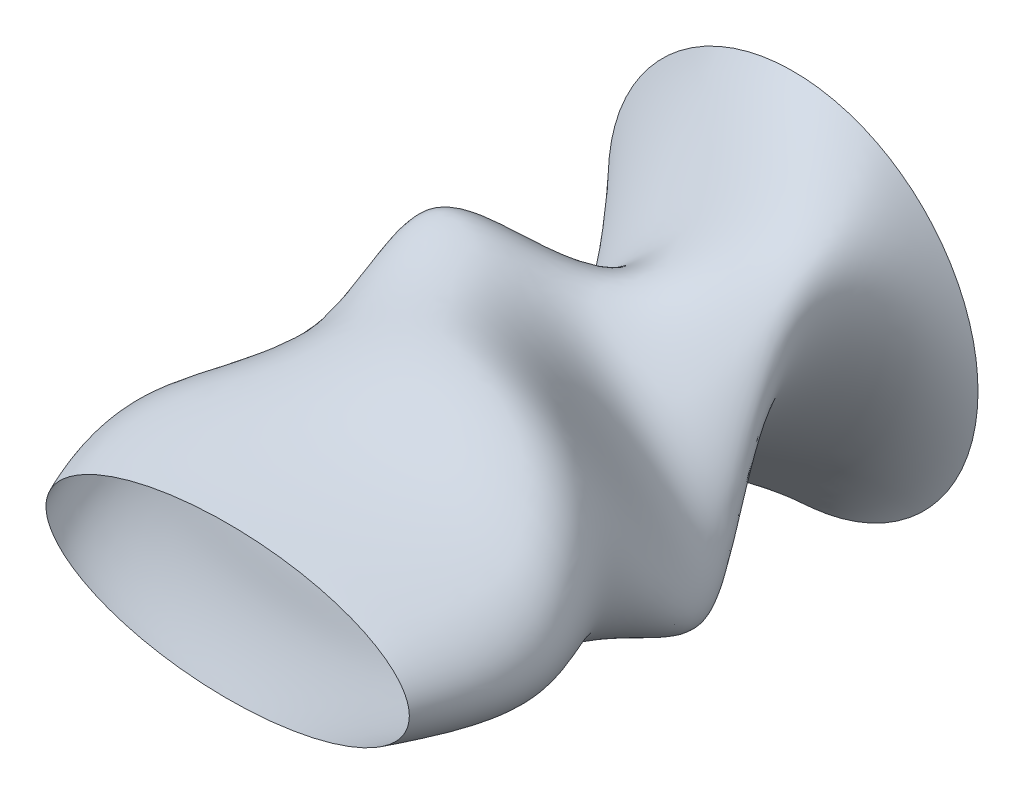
SolidWorks part; units mm, degrees
ref_plane "Ebene vorne" through (0, 0, 0) normal (0, 0, 1) x (1, 0, 0)
ref_plane "Ebene oben" through (0, 0, 0) normal (0, 1, 0) x (1, 0, 0)
ref_plane "Ebene rechts" through (0, 0, 0) normal (1, 0, 0) x (0, 0, -1)
sketch "Skizze1" plane through (0, 0, 0) normal (0, 0, 1) x (1, 0, 0)
  ellipse E0 centre (0, 0) end of major axis (-80.3066, 0) minor radius 33.6005
ref_plane "Ebene1" through (0, 0, -50) normal (0, 0, 1) x (1, 0, 0)
ref_plane "Ebene2" through (0, 0, -100) normal (0, 0, 1) x (1, 0, 0)
ref_plane "Ebene3" through (0, 0, -150) normal (0, 0, 1) x (1, 0, 0)
ref_plane "Ebene4" through (0, 0, -200) normal (0, 0, 1) x (1, 0, 0)
ref_plane "Ebene5" through (0, 0, -250) normal (0, 0, 1) x (1, 0, 0)
sketch "Skizze2" plane through (0, 0, -50) normal (0, 0, 1) x (1, 0, 0)
  ellipse E0 centre (0, 0) end of major axis (-91.8833, 0) minor radius 40.8479
sketch "Skizze3" plane through (0, 0, -100) normal (0, 0, 1) x (1, 0, 0)
  ellipse E0 centre (0, 0) end of major axis (73.5229, 0) minor radius 52.1161
sketch "Skizze4" plane through (0, 0, -150) normal (0, 0, 1) x (1, 0, 0)
  ellipse E0 centre (0, 0) end of major axis (-60.5219, 48.0813) minor radius 30.2483
sketch "Skizze5" plane through (0, 0, -200) normal (0, 0, 1) x (1, 0, 0)
  ellipse E0 centre (0, 0) end of major axis (-51.117, -49.8703) minor radius 32.099
sketch "Skizze6" plane through (0, 0, -250) normal (0, 0, 1) x (1, 0, 0)
  circle A0 centre (0, 0) radius 81.7046
surface "Oberfläche-Ausformung1"
equation "\"LÄNGE\"=0"
equation "\"BREITE\"=0"
equation "\"HÖHE\"=0"
equation "\"DURCHMESSER\"=0"
equation "\"Stückzahl\"= 1"
